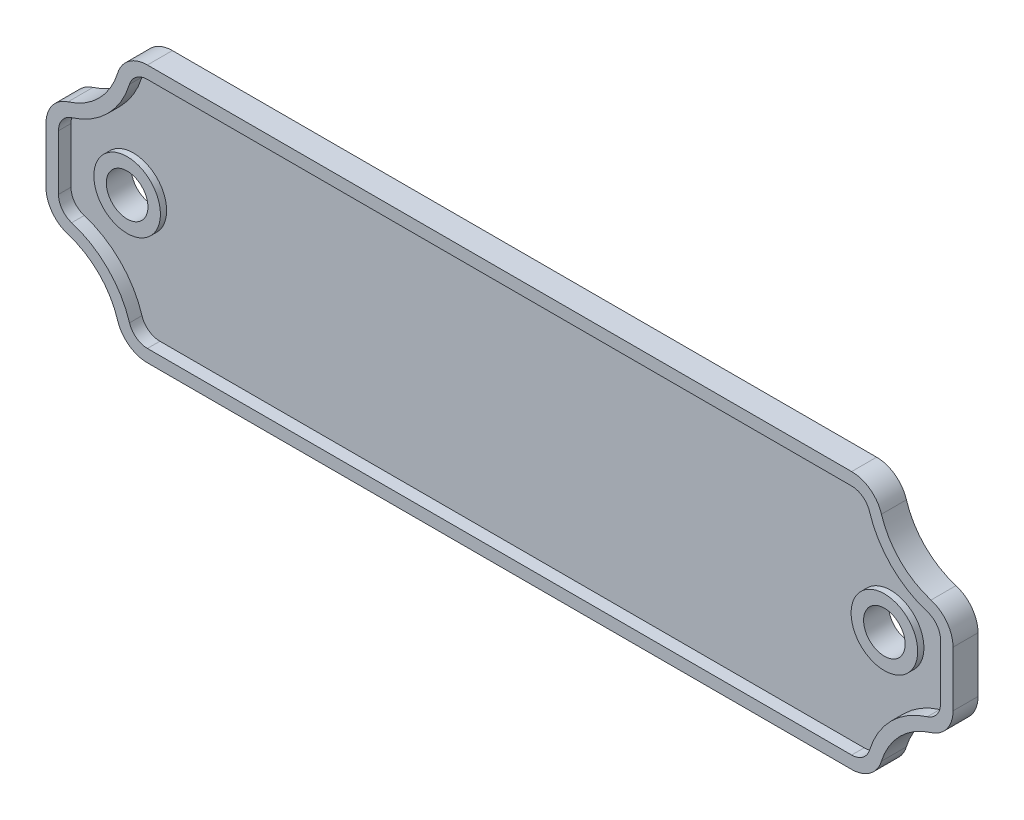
SolidWorks part; units mm, degrees
ref_plane "Front Plane" through (0, 0, 0) normal (0, 0, 1) x (1, 0, 0)
ref_plane "Top Plane" through (0, 0, 0) normal (0, 1, 0) x (1, 0, 0)
ref_plane "Right Plane" through (0, 0, 0) normal (1, 0, 0) x (0, 0, -1)
sketch "Sketch1" plane through (0, 0, 0) normal (0, 0, 1) x (1, 0, 0)
  line L0 (-54.3624, 3.3139) -> (-54.3624, -3.3139)
  line L1 (-42.1764, 15.5) -> (42.4515, 15.5)
  line L2 (54.6376, 3.3139) -> (54.6376, -3.3139)
  line L3 (42.4515, -15.5) -> (-42.1764, -15.5)
  arc A0 (-51.7154, 6.8981) -> (-45.7605, 12.8529) centre (-54.3624, 15.5) ccw
  arc A2 (46.0356, 12.8529) -> (51.9905, 6.8981) centre (54.6376, 15.5) ccw
  arc A3 (51.9905, -6.8981) -> (46.0356, -12.8529) centre (54.6376, -15.5) ccw
  arc A4 (-45.7605, -12.8529) -> (-51.7154, -6.8981) centre (-54.3624, -15.5) ccw
  circle A5 centre (-45.3624, 0) radius 2.5
  circle A6 centre (45.6376, 0) radius 2.5
  arc A7 (-54.3624, 3.3139) -> (-51.7154, 6.8981) centre (-50.6124, 3.3139) cw
  arc A8 (-54.3624, -3.3139) -> (-51.7154, -6.8981) centre (-50.6124, -3.3139) ccw
  arc A9 (-45.7605, -12.8529) -> (-42.1764, -15.5) centre (-42.1764, -11.75) ccw
  arc A10 (42.4515, -15.5) -> (46.0356, -12.8529) centre (42.4515, -11.75) ccw
  arc A11 (51.9905, -6.8981) -> (54.6376, -3.3139) centre (50.8876, -3.3139) ccw
  arc A12 (54.6376, 3.3139) -> (51.9905, 6.8981) centre (50.8876, 3.3139) ccw
  arc A13 (46.0356, 12.8529) -> (42.4515, 15.5) centre (42.4515, 11.75) ccw
  arc A14 (-42.1764, 15.5) -> (-45.7605, 12.8529) centre (-42.1764, 11.75) ccw
  point P20 (-54.3624, 6.5)
  point P25 (-54.3624, -6.5)
  point P33 (54.6376, -6.5)
  point P36 (54.6376, 6.5)
  point P44 (0, 0)
  point P46 (0, 0)
  point P47 (0, 0)
  dimension "D1" = 5
  dimension "D2" = 9
  dimension "D3" = 3.75
  dimension "D4" = 9
  dimension "D7" = 31
  dimension "D9" = 54.6376
  dimension "D5" = 9
  dimension "D6" = 109
  dimension "D8" = 15.5
other "AlignGroup1"
other "AlignGroup2"
extrude "Boss-Extrude1" add sketch "Sketch1" along normal mid plane 1.5
sketch "Sketch3" plane through (0, 0, 0.75) normal (0, 0, 1) x (1, 0, 0)
  line L0 (54.6376, -3.3139) -> (54.6376, 3.3139) construction
  line L1 (-42.1764, -15.5) -> (42.4515, -15.5) construction
  line L2 (-54.3624, 3.3139) -> (-54.3624, -3.3139) construction
  line L3 (42.4515, 15.5) -> (-42.1764, 15.5) construction
  line L4 (54.6376, -3.3139) -> (54.6376, 3.3139)
  line L5 (-42.1764, -15.5) -> (42.4515, -15.5)
  line L6 (-54.3624, 3.3139) -> (-54.3624, -3.3139)
  line L7 (42.4515, 15.5) -> (-42.1764, 15.5)
  line L8 (53.1376, -3.3139) -> (53.1376, 3.3139)
  line L9 (42.4515, 14) -> (-42.1764, 14)
  line L10 (-52.8624, 3.3139) -> (-52.8624, -3.3139)
  line L11 (-42.1764, -14) -> (42.4515, -14)
  arc A0 (46.0356, 12.8529) -> (42.4515, 15.5) centre (42.4515, 11.75) ccw construction
  arc A1 (46.0356, 12.8529) -> (51.9905, 6.8981) centre (54.6376, 15.5) ccw construction
  arc A2 (54.6376, 3.3139) -> (51.9905, 6.8981) centre (50.8876, 3.3139) ccw construction
  arc A3 (51.9905, -6.8981) -> (54.6376, -3.3139) centre (50.8876, -3.3139) ccw construction
  arc A4 (51.9905, -6.8981) -> (46.0356, -12.8529) centre (54.6376, -15.5) ccw construction
  arc A5 (42.4515, -15.5) -> (46.0356, -12.8529) centre (42.4515, -11.75) ccw construction
  arc A6 (-45.7605, -12.8529) -> (-42.1764, -15.5) centre (-42.1764, -11.75) ccw construction
  arc A7 (-45.7605, -12.8529) -> (-51.7154, -6.8981) centre (-54.3624, -15.5) ccw construction
  arc A8 (-54.3624, -3.3139) -> (-51.7154, -6.8981) centre (-50.6124, -3.3139) ccw construction
  arc A9 (-51.7154, 6.8981) -> (-54.3624, 3.3139) centre (-50.6124, 3.3139) ccw construction
  arc A10 (-51.7154, 6.8981) -> (-45.7605, 12.8529) centre (-54.3624, 15.5) ccw construction
  arc A11 (-42.1764, 15.5) -> (-45.7605, 12.8529) centre (-42.1764, 11.75) ccw construction
  arc A12 (46.0356, 12.8529) -> (42.4515, 15.5) centre (42.4515, 11.75) ccw
  arc A13 (46.0356, 12.8529) -> (51.9905, 6.8981) centre (54.6376, 15.5) ccw
  arc A14 (54.6376, 3.3139) -> (51.9905, 6.8981) centre (50.8876, 3.3139) ccw
  arc A15 (51.9905, -6.8981) -> (54.6376, -3.3139) centre (50.8876, -3.3139) ccw
  arc A16 (51.9905, -6.8981) -> (46.0356, -12.8529) centre (54.6376, -15.5) ccw
  arc A17 (42.4515, -15.5) -> (46.0356, -12.8529) centre (42.4515, -11.75) ccw
  arc A18 (-45.7605, -12.8529) -> (-42.1764, -15.5) centre (-42.1764, -11.75) ccw
  arc A19 (-45.7605, -12.8529) -> (-51.7154, -6.8981) centre (-54.3624, -15.5) ccw
  arc A20 (-54.3624, -3.3139) -> (-51.7154, -6.8981) centre (-50.6124, -3.3139) ccw
  arc A21 (-51.7154, 6.8981) -> (-54.3624, 3.3139) centre (-50.6124, 3.3139) ccw
  arc A22 (-51.7154, 6.8981) -> (-45.7605, 12.8529) centre (-54.3624, 15.5) ccw
  arc A23 (-42.1764, 15.5) -> (-45.7605, 12.8529) centre (-42.1764, 11.75) ccw
  arc A24 (53.1376, 3.3139) -> (51.5493, 5.4644) centre (50.8876, 3.3139) ccw
  arc A25 (44.602, 12.4118) -> (51.5493, 5.4644) centre (54.6376, 15.5) ccw
  arc A26 (44.602, 12.4118) -> (42.4515, 14) centre (42.4515, 11.75) ccw
  arc A27 (-42.1764, 14) -> (-44.3269, 12.4118) centre (-42.1764, 11.75) ccw
  arc A28 (-51.2742, 5.4644) -> (-44.3269, 12.4118) centre (-54.3624, 15.5) ccw
  arc A29 (-51.2742, 5.4644) -> (-52.8624, 3.3139) centre (-50.6124, 3.3139) ccw
  arc A30 (-52.8624, -3.3139) -> (-51.2742, -5.4644) centre (-50.6124, -3.3139) ccw
  arc A31 (-44.3269, -12.4118) -> (-51.2742, -5.4644) centre (-54.3624, -15.5) ccw
  arc A32 (-44.3269, -12.4118) -> (-42.1764, -14) centre (-42.1764, -11.75) ccw
  arc A33 (42.4515, -14) -> (44.602, -12.4118) centre (42.4515, -11.75) ccw
  arc A34 (51.5493, -5.4644) -> (44.602, -12.4118) centre (54.6376, -15.5) ccw
  arc A35 (51.5493, -5.4644) -> (53.1376, -3.3139) centre (50.8876, -3.3139) ccw
extrude "Boss-Extrude2" add sketch "Sketch3" along normal blind 1.5
sketch "Sketch5" plane through (0, 0, 0) normal (0, 0, 1) x (1, 0, 0)
  circle A0 centre (45.6376, 0) radius 2.5 construction
  circle A1 centre (-45.3624, 0) radius 2.5 construction
  circle A2 centre (45.6376, 0) radius 2.5
  circle A3 centre (-45.3624, 0) radius 2.5
  circle A4 centre (-45.3624, 0) radius 4
  circle A5 centre (45.6376, 0) radius 4
extrude "Boss-Extrude3" add sketch "Sketch5" along normal mid plane 3
equation "\"A\" = 1.5"
equation "\"B\"= 109"
equation "\"D1@Boss-Extrude1\"=\"A\""
equation "\"D1@Sketch3\"= \"A\""
equation "\"D1@Boss-Extrude2\"=\"A\""
equation "\"D1@Sketch5\"=5+(2*\"A\")"
equation "\"D1@Boss-Extrude3\"=2*\"A\""
